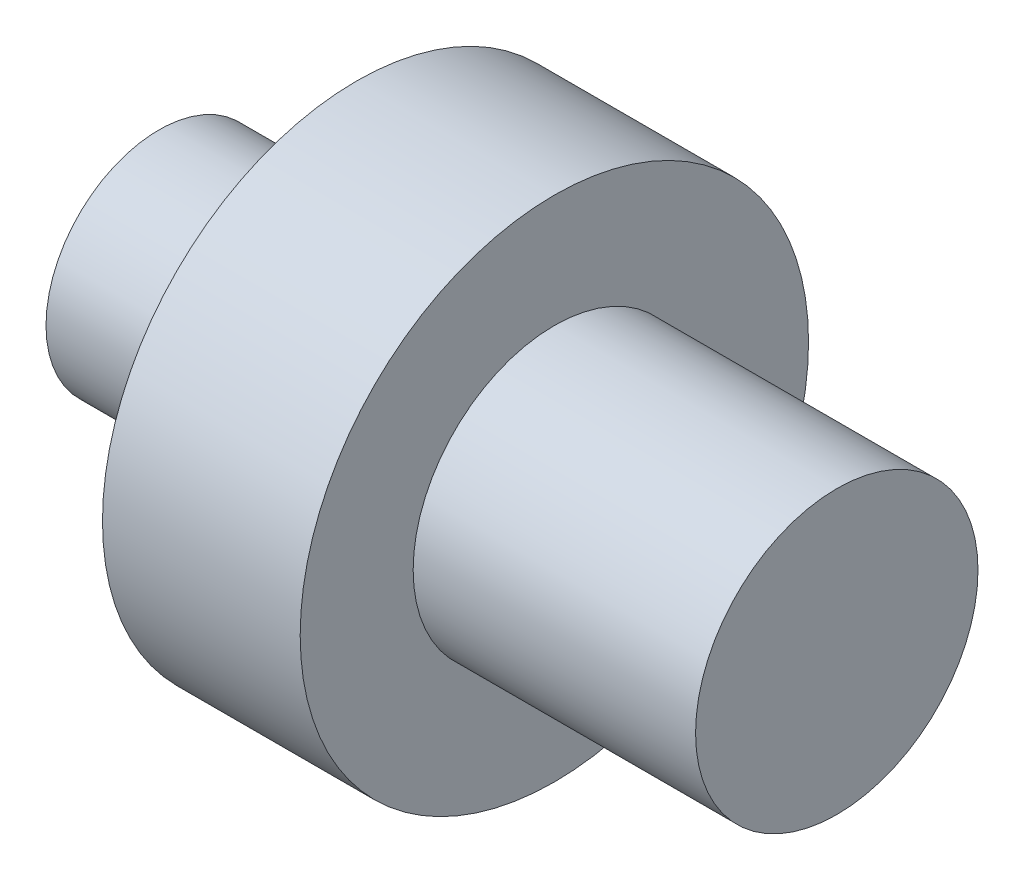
SolidWorks part; units mm, degrees
ref_plane "前视基准面" through (0, 0, 0) normal (0, 0, 1) x (1, 0, 0)
ref_plane "上视基准面" through (0, 0, 0) normal (0, 1, 0) x (1, 0, 0)
ref_plane "右视基准面" through (0, 0, 0) normal (1, 0, 0) x (0, 0, -1)
sketch "草图1" plane through (0, 0, 0) normal (1, 0, 0) x (0, 0, -1)
  circle A0 centre (0, 0) radius 20
extrude "拉伸1" add sketch "草图1" against normal blind 40
sketch "草图2" plane through (-40, 0, 0) normal (-1, 0, 0) x (0, 0, 1)
  circle A0 centre (0, 0) radius 36
extrude "拉伸2" add sketch "草图2" along normal blind 28
sketch "草图3" plane through (-68, 0, 0) normal (-1, 0, 0) x (0, 0, 1)
  circle A0 centre (0, 0) radius 16
extrude "拉伸3" add sketch "草图3" along normal blind 28
